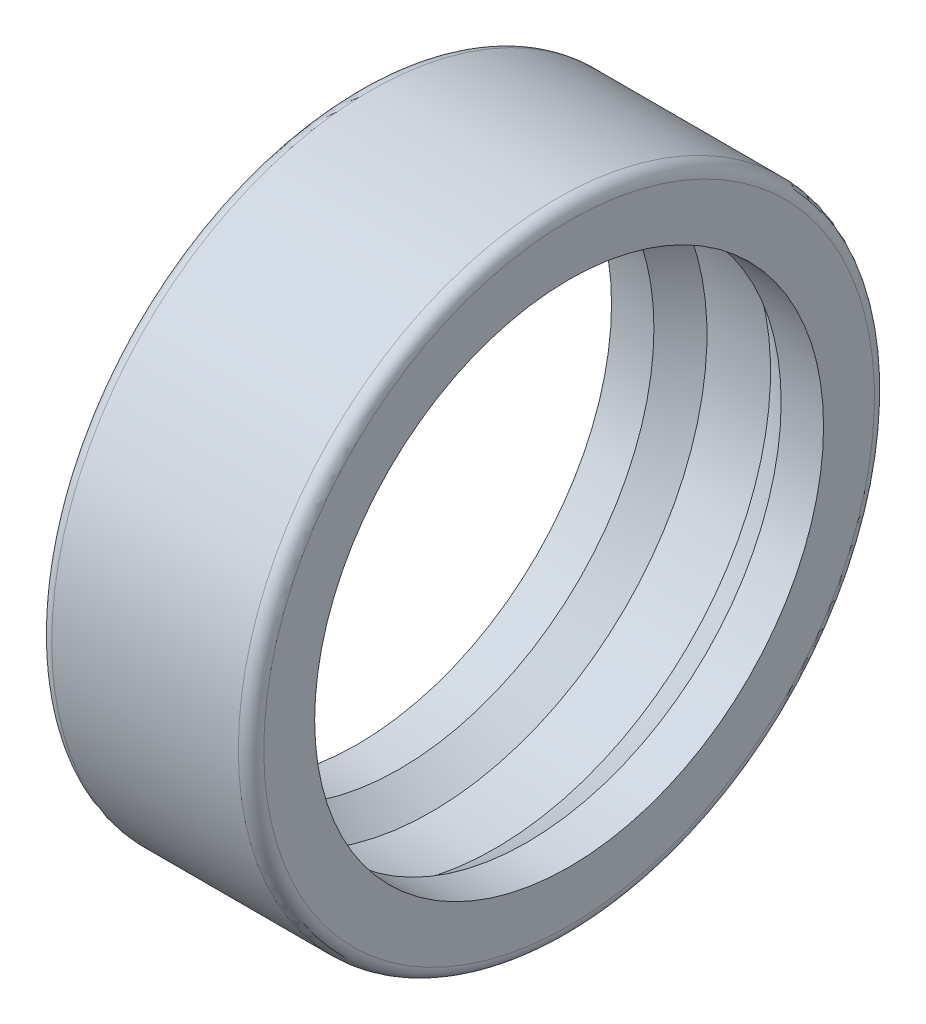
SolidWorks part; units mm, degrees
ref_plane "Front Plane" through (0, 0, 0) normal (0, 0, 1) x (1, 0, 0)
ref_plane "Top Plane" through (0, 0, 0) normal (0, 1, 0) x (1, 0, 0)
ref_plane "Right Plane" through (0, 0, 0) normal (1, 0, 0) x (0, 0, -1)
sketch "Sketch1" plane through (0, 0, 0) normal (0, 0, 1) x (1, 0, 0)
  line L0 (-0.75, 6.5) -> (0.75, 6.5)
  line L1 (-2.5, 7.5) -> (2.5, 7.5)
  line L2 (-2.5, 7.5) -> (-2.5, 6)
  line L3 (-2.5, 0) -> (2.5, 0) construction
  line L4 (2.5, 7.5) -> (2.5, 6)
  line L5 (0.75, 6.5) -> (1.5, 6)
  line L6 (1.5, 6) -> (2.5, 6)
  line L7 (-0.75, 6.5) -> (-1.5, 6)
  line L8 (-1.5, 6) -> (-2.5, 6)
  point P11 (0, 6.5)
  point P13 (0, 7.5)
  dimension "D1" = 7.5
  dimension "D2" = 1.5
  dimension "D3" = 5
  dimension "D4" = 1
  dimension "D5" = 1.5
  dimension "D6" = 1
revolve "Revolve1" add sketch "Sketch1" angle 360 about L3
fillet "Fillet1" radius 0.3 2 edges at (2.5, 0, 7.5) (-2.5, 0, 7.5)
